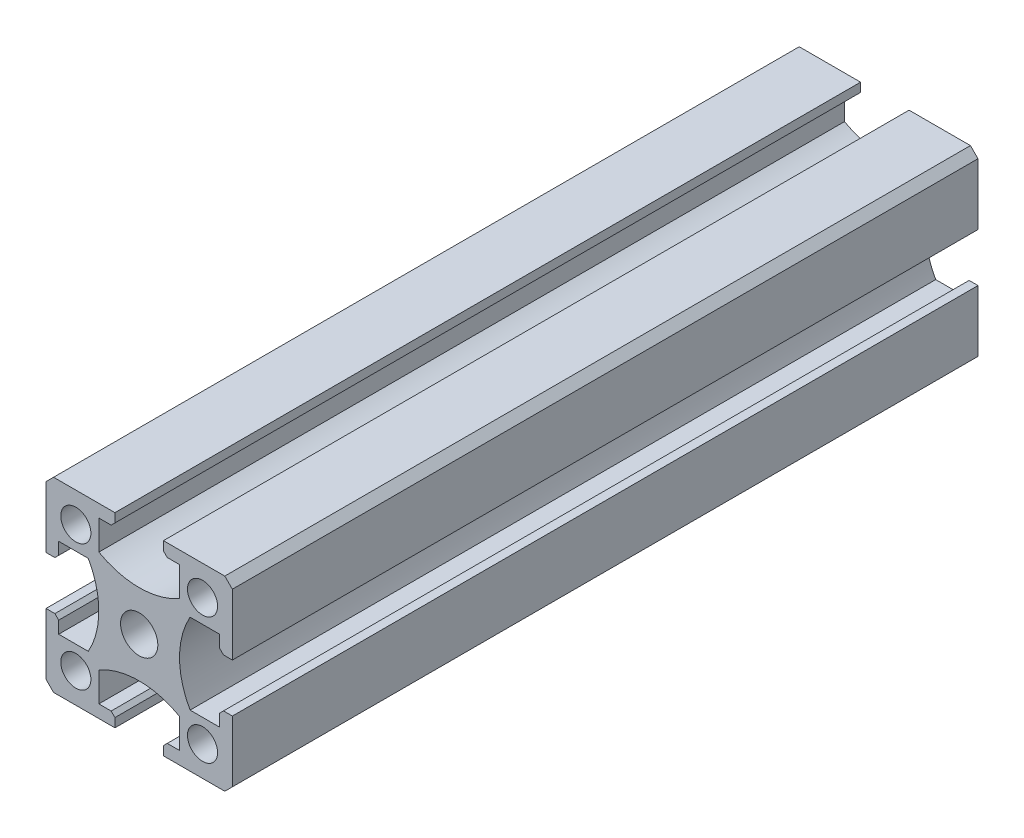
SolidWorks part; units mm, degrees
ref_plane "Front" through (0, 0, 0) normal (0, 0, 1) x (1, 0, 0)
ref_plane "Top" through (0, 0, 0) normal (0, 1, 0) x (1, 0, 0)
ref_plane "Right" through (0, 0, 0) normal (1, 0, 0) x (0, 0, -1)
imported_body "3191-001-1-solid1"
sketch "Esquisse1" plane through (0, 0, 0) normal (0, 0, 1) x (1, 0, 0)
  line L0 (-3.2512, 12.4968) -> (-11.4808, 12.4968)
  line L1 (-11.4808, 12.4968) -> (-12.4968, 11.4808)
  line L2 (-12.4968, 11.4808) -> (-12.4968, 3.2512)
  line L3 (-12.4968, 11.4808) -> (-12.4968, 3.2512) construction
  line L4 (-12.4968, 3.2512) -> (-11.303, 3.2512)
  line L5 (-11.303, 3.2512) -> (-10.795, 3.7592)
  line L6 (-10.795, 3.7592) -> (-10.795, 5.3975)
  line L7 (-10.795, 5.3975) -> (-6.8257, 5.3975)
  line L8 (-3.2512, 12.4968) -> (-3.2512, 11.303)
  line L9 (-3.2512, 11.303) -> (-3.7592, 10.795)
  line L10 (-3.7592, 10.795) -> (-5.4102, 10.795)
  line L11 (-5.4102, 10.795) -> (-5.4102, 6.8329)
  line L12 (5.4102, 6.8329) -> (5.4102, 10.795)
  line L13 (5.4102, 10.795) -> (3.7592, 10.795)
  line L14 (3.7592, 10.795) -> (3.2512, 11.303)
  line L15 (3.2512, 11.303) -> (3.2512, 12.4968)
  line L16 (3.2512, 12.4968) -> (11.4808, 12.4968)
  line L17 (11.4808, 12.4968) -> (12.4968, 11.4808)
  line L18 (12.4968, 11.4808) -> (12.4968, 3.2512)
  line L19 (12.4968, 3.2512) -> (11.303, 3.2512)
  line L20 (11.303, 3.2512) -> (10.795, 3.7592)
  line L21 (10.795, 3.7592) -> (10.795, 5.3975)
  line L22 (10.795, 5.3975) -> (6.8257, 5.3975)
  line L23 (6.8257, -5.3975) -> (10.795, -5.3975)
  line L24 (10.795, -5.3975) -> (10.795, -3.7592)
  line L25 (10.795, -3.7592) -> (11.303, -3.2512)
  line L26 (11.303, -3.2512) -> (12.4968, -3.2512)
  line L27 (12.4968, -3.2512) -> (12.4968, -11.4808)
  line L28 (12.4968, -11.4808) -> (11.4808, -12.4968)
  line L29 (11.4808, -12.4968) -> (3.2512, -12.4968)
  line L30 (3.2512, -12.4968) -> (3.2512, -11.303)
  line L31 (3.2512, -11.303) -> (3.7592, -10.795)
  line L32 (3.7592, -10.795) -> (5.4102, -10.795)
  line L33 (5.4102, -10.795) -> (5.4102, -6.8329)
  line L34 (-5.4102, -6.8329) -> (-5.4102, -10.795)
  line L35 (-5.4102, -10.795) -> (-3.7592, -10.795)
  line L36 (-3.7592, -10.795) -> (-3.2512, -11.303)
  line L37 (-3.2512, -11.303) -> (-3.2512, -12.4968)
  line L38 (-3.2512, -12.4968) -> (-11.4808, -12.4968)
  line L39 (-11.4808, -12.4968) -> (-12.4968, -11.4808)
  line L40 (-12.4968, -11.4808) -> (-12.4968, -3.2512)
  line L41 (-12.4968, -3.2512) -> (-11.303, -3.2512)
  line L42 (-11.303, -3.2512) -> (-10.795, -3.7592)
  line L43 (-10.795, -3.7592) -> (-10.795, -5.3975)
  line L44 (-10.795, -5.3975) -> (-6.8257, -5.3975)
  circle A0 centre (0, 0) radius 2.5
  circle A1 centre (-8.4963, -8.4963) radius 2.0193
  circle A2 centre (-8.4963, 8.4963) radius 2.0193
  circle A3 centre (8.4963, 8.4963) radius 2.0193
  circle A4 centre (8.4963, -8.4963) radius 2.0193
  arc A5 (5.4102, 6.8329) -> (-5.4102, 6.8329) centre (0, 16.4084) cw
  arc A6 (-5.4102, 6.8329) -> (5.4102, 6.8329) centre (0, 16.4084) ccw construction
  arc A7 (-6.8257, 5.3975) -> (-6.8257, -5.3975) centre (-16.4084, 0) cw
  arc A8 (-6.8257, -5.3975) -> (-6.8257, 5.3975) centre (-16.4084, 0) ccw construction
  arc A9 (6.8257, 5.3975) -> (6.8257, -5.3975) centre (16.4084, 0) ccw
  arc A10 (-5.4102, -6.8329) -> (5.4102, -6.8329) centre (0, -16.4084) cw
  arc A11 (5.4102, -6.8329) -> (-5.4102, -6.8329) centre (0, -16.4084) ccw construction
extrude "Boss.-Extru.1" add sketch "Esquisse1" along normal blind 100 separate body contours L34 A10 L33 L32 L31 L30 L29 L28 L27 L26 L25 L24 L23 A9 L22 L21 L20 L19 L18 L17 L16 L15 L14 L13 L12 A5 L11 L10 L9 L8 L0 L1 L2 L4 L5 L6 L7 A7 L44 L43 L42 L41 L40 L39 L38 L37 L36 L35 A0
